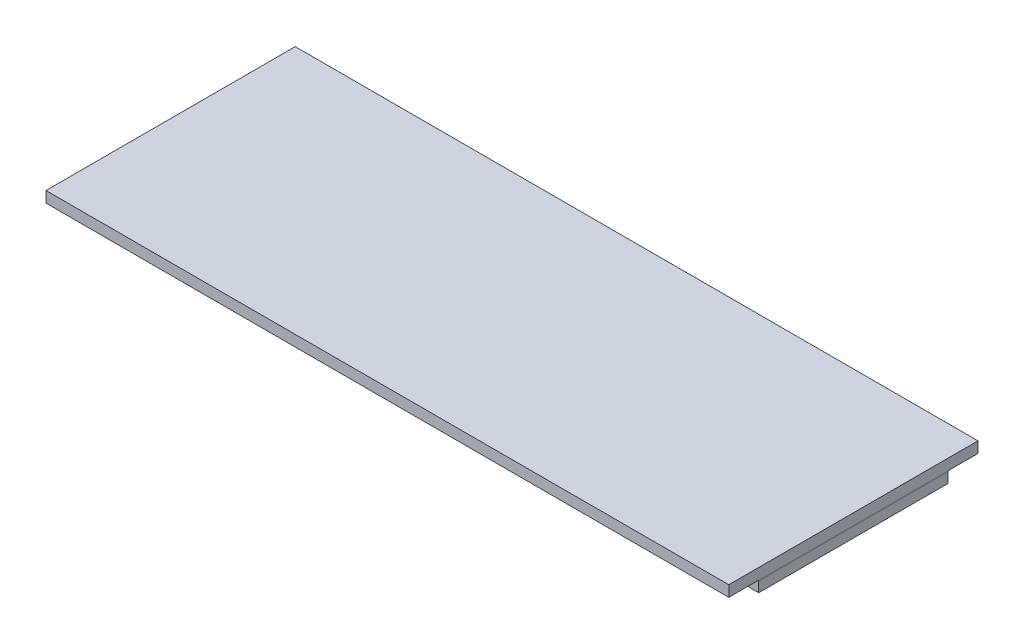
SolidWorks part; units mm, degrees
ref_plane "Front Plane" through (0, 0, 0) normal (0, 0, 1) x (1, 0, 0)
ref_plane "Top Plane" through (0, 0, 0) normal (0, 1, 0) x (1, 0, 0)
ref_plane "Right Plane" through (0, 0, 0) normal (1, 0, 0) x (0, 0, -1)
sketch "Sketch1" plane through (0, 0, 0) normal (0, 1, 0) x (1, 0, 0)
  line L0 (-81.0446, 0) -> (81.0446, 0) construction
  line L1 (-34.25, 12.5) -> (34.25, 12.5)
  line L2 (-34.25, 12.5) -> (-34.25, -12.5)
  line L3 (-34.25, -12.5) -> (34.25, -12.5)
  line L4 (34.25, 12.5) -> (34.25, -12.5)
  line L5 (0, -22.2823) -> (0, 22.2823) construction
  dimension "D1" = 68.5
  dimension "D2" = 25
  dimension "D3" = 12.5
  dimension "D4" = 34.25
extrude "Boss-Extrude1" add sketch "Sketch1" along normal blind 1.1
sketch "Sketch2" plane through (0, 0, 0) normal (0, 1, 0) x (1, 0, 0)
  line L0 (-34.25, 12.5) -> (-34.25, -12.5) construction
  line L1 (-34.25, 9.5) -> (34.25, 9.5)
  line L2 (-34.25, 9.5) -> (-34.25, -9.5)
  line L3 (-34.25, -9.5) -> (34.25, -9.5)
  line L4 (34.25, 9.5) -> (34.25, -9.5)
  line L5 (34.25, -12.5) -> (34.25, 12.5) construction
  line L6 (-55, 0) -> (55, 0) construction
  dimension "D1" = 19
  dimension "D2" = 9.5
extrude "Boss-Extrude2" add sketch "Sketch2" against normal blind 0.1 separate body
sketch "Sketch3"
  dimension "D1" = 2.95
  dimension "D2" = 0.1
  dimension "D3" = 4.35
  dimension "D4" = 25.9
  dimension "D5" = 4.75
  dimension "D6" = 0.51
  dimension "D7" = 0.05
  dimension "D8" = 16
  dimension "D10" = 3.65
  dimension "D11" = 5.15
  dimension "D9" = 2
sketch "Sketch5" plane through (0, 0, 0) normal (0, 1, 0) x (1, 0, 0)
  line L0 (0.35, 2.05) -> (0.86, 2.05) construction
  line L1 (-8.16, 4.2) -> (-7.65, 4.2)
  line L2 (-8.16, 4.2) -> (-8.16, 3.7)
  line L3 (-8.16, 3.7) -> (-7.65, 3.7)
  line L4 (-7.65, 4.2) -> (-7.65, 3.7)
  line L5 (-8.77, 4.75) -> (-8.26, 4.75)
  line L6 (-8.77, 4.75) -> (-8.77, 4.25)
  line L7 (-8.77, 4.25) -> (-8.26, 4.25)
  line L8 (-8.26, 4.75) -> (-8.26, 4.25)
  line L9 (-9.38, 4.75) -> (-8.87, 4.75)
  line L10 (-9.38, 4.75) -> (-9.38, 4.25)
  line L11 (-9.38, 4.25) -> (-8.87, 4.25)
  line L12 (-8.87, 4.75) -> (-8.87, 4.25)
  line L13 (-9.99, 4.75) -> (-9.48, 4.75)
  line L14 (-9.99, 4.75) -> (-9.99, 4.25)
  line L15 (-9.99, 4.25) -> (-9.48, 4.25)
  line L16 (-9.48, 4.75) -> (-9.48, 4.25)
  line L17 (-10.6, 4.2) -> (-10.09, 4.2)
  line L18 (-10.6, 4.2) -> (-10.6, 3.7)
  line L19 (-10.6, 3.7) -> (-10.09, 3.7)
  line L20 (-10.09, 4.2) -> (-10.09, 3.7)
  line L21 (-10.6, 3.65) -> (-10.09, 3.65)
  line L22 (-10.6, 3.65) -> (-10.6, 3.15)
  line L23 (-10.6, 3.15) -> (-10.09, 3.15)
  line L24 (-10.09, 3.65) -> (-10.09, 3.15)
  line L25 (-10.6, 3.1) -> (-10.09, 3.1)
  line L26 (-10.6, 3.1) -> (-10.6, 2.6)
  line L27 (-10.6, 2.6) -> (-10.09, 2.6)
  line L28 (-10.09, 3.1) -> (-10.09, 2.6)
  line L29 (-10.6, 2.55) -> (-10.09, 2.55)
  line L30 (-10.6, 2.55) -> (-10.6, 2.05)
  line L31 (-10.6, 2.05) -> (-10.09, 2.05)
  line L32 (-10.09, 2.55) -> (-10.09, 2.05)
  line L33 (-10.6, 2) -> (-10.09, 2)
  line L34 (-10.6, 2) -> (-10.6, 1.5)
  line L35 (-10.6, 1.5) -> (-10.09, 1.5)
  line L36 (-10.09, 2) -> (-10.09, 1.5)
  line L37 (-9.99, 1.45) -> (-9.48, 1.45)
  line L38 (-9.99, 1.45) -> (-9.99, 0.95)
  line L39 (-9.99, 0.95) -> (-9.48, 0.95)
  line L40 (-9.48, 1.45) -> (-9.48, 0.95)
  line L41 (-9.38, 1.45) -> (-8.87, 1.45)
  line L42 (-9.38, 1.45) -> (-9.38, 0.95)
  line L43 (-9.38, 0.95) -> (-8.87, 0.95)
  line L44 (-8.87, 1.45) -> (-8.87, 0.95)
  line L45 (-8.77, 1.45) -> (-8.26, 1.45)
  line L46 (-8.77, 1.45) -> (-8.77, 0.95)
  line L47 (-8.77, 0.95) -> (-8.26, 0.95)
  line L48 (-8.26, 1.45) -> (-8.26, 0.95)
  line L49 (-8.16, 1.45) -> (-7.65, 1.45)
  line L50 (-8.16, 1.45) -> (-8.16, 0.95)
  line L51 (-8.16, 0.95) -> (-7.65, 0.95)
  line L52 (-7.65, 1.45) -> (-7.65, 0.95)
  line L53 (-6.95, 1.45) -> (-6.44, 1.45)
  line L54 (-6.95, 1.45) -> (-6.95, 0.95)
  line L55 (-6.95, 0.95) -> (-6.44, 0.95)
  line L56 (-6.44, 1.45) -> (-6.44, 0.95)
  line L57 (-8.16, 2) -> (-7.65, 2)
  line L58 (-8.16, 2) -> (-8.16, 1.5)
  line L59 (-8.16, 1.5) -> (-7.65, 1.5)
  line L60 (-7.65, 2) -> (-7.65, 1.5)
  line L61 (-8.16, 2.55) -> (-7.65, 2.55)
  line L62 (-8.16, 2.55) -> (-8.16, 2.05)
  line L63 (-8.16, 2.05) -> (-7.65, 2.05)
  line L64 (-7.65, 2.55) -> (-7.65, 2.05)
  line L65 (-8.16, 3.1) -> (-7.65, 3.1)
  line L66 (-8.16, 3.1) -> (-8.16, 2.6)
  line L67 (-8.16, 2.6) -> (-7.65, 2.6)
  line L68 (-7.65, 3.1) -> (-7.65, 2.6)
  line L69 (-8.77, 3.1) -> (-8.26, 3.1)
  line L70 (-8.77, 3.1) -> (-8.77, 2.6)
  line L71 (-8.77, 2.6) -> (-8.26, 2.6)
  line L72 (-8.26, 3.1) -> (-8.26, 2.6)
  line L73 (-9.38, 3.1) -> (-8.87, 3.1)
  line L74 (-9.38, 3.1) -> (-9.38, 2.6)
  line L75 (-9.38, 2.6) -> (-8.87, 2.6)
  line L76 (-8.87, 3.1) -> (-8.87, 2.6)
  line L77 (-6.95, 2) -> (-6.44, 2)
  line L78 (-6.95, 2) -> (-6.95, 1.5)
  line L79 (-6.95, 1.5) -> (-6.44, 1.5)
  line L80 (-6.44, 2) -> (-6.44, 1.5)
  line L81 (-6.95, 2.55) -> (-6.44, 2.55)
  line L82 (-6.95, 2.55) -> (-6.95, 2.05)
  line L83 (-6.95, 2.05) -> (-6.44, 2.05)
  line L84 (-6.44, 2.55) -> (-6.44, 2.05)
  line L85 (-6.95, 3.1) -> (-6.44, 3.1)
  line L86 (-6.95, 3.1) -> (-6.95, 2.6)
  line L87 (-6.95, 2.6) -> (-6.44, 2.6)
  line L88 (-6.44, 3.1) -> (-6.44, 2.6)
  line L89 (-6.95, 3.65) -> (-6.44, 3.65)
  line L90 (-6.95, 3.65) -> (-6.95, 3.15)
  line L91 (-6.95, 3.15) -> (-6.44, 3.15)
  line L92 (-6.44, 3.65) -> (-6.44, 3.15)
  line L93 (-6.34, 3.1) -> (-5.83, 3.1)
  line L94 (-6.34, 3.1) -> (-6.34, 2.6)
  line L95 (-6.34, 2.6) -> (-5.83, 2.6)
  line L96 (-5.83, 3.1) -> (-5.83, 2.6)
  line L97 (-5.73, 3.65) -> (-5.22, 3.65)
  line L98 (-5.73, 3.65) -> (-5.73, 3.15)
  line L99 (-5.73, 3.15) -> (-5.22, 3.15)
  line L100 (-5.22, 3.65) -> (-5.22, 3.15)
  line L101 (-5.12, 3.65) -> (-4.61, 3.65)
  line L102 (-5.12, 3.65) -> (-5.12, 3.15)
  line L103 (-5.12, 3.15) -> (-4.61, 3.15)
  line L104 (-4.61, 3.65) -> (-4.61, 3.15)
  line L105 (-4.51, 3.1) -> (-4, 3.1)
  line L106 (-4.51, 3.1) -> (-4.51, 2.6)
  line L107 (-4.51, 2.6) -> (-4, 2.6)
  line L108 (-4, 3.1) -> (-4, 2.6)
  line L109 (-3.3, 2) -> (-2.79, 2)
  line L110 (-3.3, 2) -> (-3.3, 1.5)
  line L111 (-3.3, 1.5) -> (-2.79, 1.5)
  line L112 (-2.79, 2) -> (-2.79, 1.5)
  line L113 (-2.69, 1.45) -> (-2.18, 1.45)
  line L114 (-2.69, 1.45) -> (-2.69, 0.95)
  line L115 (-2.69, 0.95) -> (-2.18, 0.95)
  line L116 (-2.18, 1.45) -> (-2.18, 0.95)
  line L117 (-2.08, 1.45) -> (-1.57, 1.45)
  line L118 (-2.08, 1.45) -> (-2.08, 0.95)
  line L119 (-2.08, 0.95) -> (-1.57, 0.95)
  line L120 (-1.57, 1.45) -> (-1.57, 0.95)
  line L121 (-0.96, 1.45) -> (-1.47, 1.45)
  line L122 (-0.96, 1.45) -> (-0.96, 0.95)
  line L123 (-0.96, 0.95) -> (-1.47, 0.95)
  line L124 (-1.47, 1.45) -> (-1.47, 0.95)
  line L125 (-0.35, 2) -> (-0.86, 2)
  line L126 (-0.35, 2) -> (-0.35, 1.5)
  line L127 (-0.35, 1.5) -> (-0.86, 1.5)
  line L128 (-0.86, 2) -> (-0.86, 1.5)
  line L129 (-0.86, 1.45) -> (-0.35, 1.45)
  line L130 (-0.86, 1.45) -> (-0.86, 0.95)
  line L131 (-0.86, 0.95) -> (-0.35, 0.95)
  line L132 (-0.35, 1.45) -> (-0.35, 0.95)
  line L133 (-2.69, 2.55) -> (-2.18, 2.55)
  line L134 (-2.69, 2.55) -> (-2.69, 2.05)
  line L135 (-2.69, 2.05) -> (-2.18, 2.05)
  line L136 (-2.18, 2.55) -> (-2.18, 2.05)
  line L137 (-2.08, 2.55) -> (-1.57, 2.55)
  line L138 (-2.08, 2.55) -> (-2.08, 2.05)
  line L139 (-2.08, 2.05) -> (-1.57, 2.05)
  line L140 (-1.57, 2.55) -> (-1.57, 2.05)
  line L141 (-1.47, 2.55) -> (-0.96, 2.55)
  line L142 (-1.47, 2.55) -> (-1.47, 2.05)
  line L143 (-1.47, 2.05) -> (-0.96, 2.05)
  line L144 (-0.96, 2.55) -> (-0.96, 2.05)
  line L145 (-0.86, 2.55) -> (-0.35, 2.55)
  line L146 (-0.86, 2.55) -> (-0.86, 2.05)
  line L147 (-0.86, 2.05) -> (-0.35, 2.05)
  line L148 (-0.35, 2.55) -> (-0.35, 2.05)
  line L149 (-2.69, 3.65) -> (-2.18, 3.65)
  line L150 (-2.69, 3.65) -> (-2.69, 3.15)
  line L151 (-2.69, 3.15) -> (-2.18, 3.15)
  line L152 (-2.18, 3.65) -> (-2.18, 3.15)
  line L153 (-2.08, 3.65) -> (-1.57, 3.65)
  line L154 (-2.08, 3.65) -> (-2.08, 3.15)
  line L155 (-2.08, 3.15) -> (-1.57, 3.15)
  line L156 (-1.57, 3.65) -> (-1.57, 3.15)
  line L157 (-1.47, 3.65) -> (-0.96, 3.65)
  line L158 (-1.47, 3.65) -> (-1.47, 3.15)
  line L159 (-1.47, 3.15) -> (-0.96, 3.15)
  line L160 (-0.96, 3.65) -> (-0.96, 3.15)
  line L161 (-0.86, 3.1) -> (-0.35, 3.1)
  line L162 (-0.86, 3.1) -> (-0.86, 2.6)
  line L163 (-0.86, 2.6) -> (-0.35, 2.6)
  line L164 (-0.35, 3.1) -> (-0.35, 2.6)
  line L165 (0.35, 4.75) -> (0.86, 4.75)
  line L166 (0.35, 4.75) -> (0.35, 4.25)
  line L167 (0.35, 4.25) -> (0.86, 4.25)
  line L168 (0.86, 4.75) -> (0.86, 4.25)
  line L169 (0.35, 4.2) -> (0.86, 4.2)
  line L170 (0.35, 4.2) -> (0.35, 3.7)
  line L171 (0.35, 3.7) -> (0.86, 3.7)
  line L172 (0.86, 4.2) -> (0.86, 3.7)
  line L173 (0.35, 3.65) -> (0.86, 3.65)
  line L174 (0.35, 3.65) -> (0.35, 3.15)
  line L175 (0.35, 3.15) -> (0.86, 3.15)
  line L176 (0.86, 3.65) -> (0.86, 3.15)
  line L177 (0.35, 3.1) -> (0.86, 3.1)
  line L178 (0.35, 3.1) -> (0.35, 2.6)
  line L179 (0.35, 2.6) -> (0.86, 2.6)
  line L180 (0.86, 3.1) -> (0.86, 2.6)
  line L181 (0.35, 2.55) -> (0.86, 2.55)
  line L182 (0.35, 2.55) -> (0.35, 2.05)
  line L183 (0.35, 2.05) -> (0.86, 2.05)
  line L184 (0.86, 2.55) -> (0.86, 2.05)
  line L185 (0.86, 2.05) -> (0.86, 2.55) construction
  line L186 (10.6, 1.5) -> (10.6, 2) construction
  line L187 (0.35, 2) -> (0.86, 2)
  line L188 (0.35, 2) -> (0.35, 1.5)
  line L189 (0.35, 1.5) -> (0.86, 1.5)
  line L190 (0.86, 2) -> (0.86, 1.5)
  line L191 (0.35, 1.45) -> (0.86, 1.45)
  line L192 (0.35, 1.45) -> (0.35, 0.9)
  line L193 (0.35, 0.9) -> (0.86, 0.9)
  line L194 (0.86, 1.45) -> (0.86, 0.9)
  line L195 (0.96, 1.45) -> (1.47, 1.45)
  line L196 (0.96, 1.45) -> (0.96, 0.95)
  line L197 (0.96, 0.95) -> (1.47, 0.95)
  line L198 (1.47, 1.45) -> (1.47, 0.95)
  line L199 (1.57, 1.45) -> (2.08, 1.45)
  line L200 (1.57, 1.45) -> (1.57, 0.95)
  line L201 (1.57, 0.95) -> (2.08, 0.95)
  line L202 (2.08, 1.45) -> (2.08, 0.95)
  line L203 (2.18, 1.45) -> (2.69, 1.45)
  line L204 (2.18, 1.45) -> (2.18, 0.95)
  line L205 (2.18, 0.95) -> (2.69, 0.95)
  line L206 (2.69, 1.45) -> (2.69, 0.95)
  line L207 (0.96, 3.1) -> (1.47, 3.1)
  line L208 (0.96, 3.1) -> (0.96, 2.6)
  line L209 (0.96, 2.6) -> (1.47, 2.6)
  line L210 (1.47, 3.1) -> (1.47, 2.6)
  line L211 (1.57, 3.65) -> (2.08, 3.65)
  line L212 (1.57, 3.65) -> (1.57, 3.15)
  line L213 (1.57, 3.15) -> (2.08, 3.15)
  line L214 (2.08, 3.65) -> (2.08, 3.15)
  line L215 (2.18, 3.65) -> (2.69, 3.65)
  line L216 (2.18, 3.65) -> (2.18, 3.15)
  line L217 (2.18, 3.15) -> (2.69, 3.15)
  line L218 (2.69, 3.65) -> (2.69, 3.15)
  line L219 (2.79, 3.1) -> (3.3, 3.1)
  line L220 (2.79, 3.1) -> (2.79, 2.6)
  line L221 (2.79, 2.6) -> (3.3, 2.6)
  line L222 (3.3, 3.1) -> (3.3, 2.6)
  line L223 (2.79, 2.55) -> (3.3, 2.55)
  line L224 (2.79, 2.55) -> (2.79, 2.05)
  line L225 (2.79, 2.05) -> (3.3, 2.05)
  line L226 (3.3, 2.55) -> (3.3, 2.05)
  line L227 (2.79, 2) -> (3.3, 2)
  line L228 (2.79, 2) -> (2.79, 1.5)
  line L229 (2.79, 1.5) -> (3.3, 1.5)
  line L230 (3.3, 2) -> (3.3, 1.5)
  line L231 (4.61, 3.65) -> (5.12, 3.65)
  line L232 (4.61, 3.65) -> (4.61, 3.15)
  line L233 (4.61, 3.15) -> (5.12, 3.15)
  line L234 (5.12, 3.65) -> (5.12, 3.15)
  line L235 (4, 3.1) -> (4.51, 3.1)
  line L236 (4, 3.1) -> (4, 2.6)
  line L237 (4, 2.6) -> (4.51, 2.6)
  line L238 (4.51, 3.1) -> (4.51, 2.6)
  line L239 (4, 2.55) -> (4.51, 2.55)
  line L240 (4, 2.55) -> (4, 2.05)
  line L241 (4, 2.05) -> (4.51, 2.05)
  line L242 (4.51, 2.55) -> (4.51, 2.05)
  line L243 (4, 2) -> (4.51, 2)
  line L244 (4, 2) -> (4, 1.5)
  line L245 (4, 1.5) -> (4.51, 1.5)
  line L246 (4.51, 2) -> (4.51, 1.5)
  line L247 (4.61, 1.45) -> (5.12, 1.45)
  line L248 (4.61, 1.45) -> (4.61, 0.95)
  line L249 (4.61, 0.95) -> (5.12, 0.95)
  line L250 (5.12, 1.45) -> (5.12, 0.95)
  line L251 (5.22, 1.45) -> (5.73, 1.45)
  line L252 (5.22, 1.45) -> (5.22, 0.95)
  line L253 (5.22, 0.95) -> (5.73, 0.95)
  line L254 (5.73, 1.45) -> (5.73, 0.95)
  line L255 (5.83, 1.45) -> (6.34, 1.45)
  line L256 (5.83, 1.45) -> (5.83, 0.95)
  line L257 (5.83, 0.95) -> (6.34, 0.95)
  line L258 (6.34, 1.45) -> (6.34, 0.95)
  line L259 (5.22, 3.65) -> (5.73, 3.65)
  line L260 (5.22, 3.65) -> (5.22, 3.15)
  line L261 (5.22, 3.15) -> (5.73, 3.15)
  line L262 (5.73, 3.65) -> (5.73, 3.15)
  line L263 (5.83, 3.65) -> (6.34, 3.65)
  line L264 (5.83, 3.65) -> (5.83, 3.15)
  line L265 (5.83, 3.15) -> (6.34, 3.15)
  line L266 (6.34, 3.65) -> (6.34, 3.15)
  line L267 (6.44, 2) -> (6.95, 2)
  line L268 (6.44, 2) -> (6.44, 1.5)
  line L269 (6.44, 1.5) -> (6.95, 1.5)
  line L270 (6.95, 2) -> (6.95, 1.5)
  line L271 (8.26, 3.65) -> (8.77, 3.65)
  line L272 (8.26, 3.65) -> (8.26, 3.15)
  line L273 (8.26, 3.15) -> (8.77, 3.15)
  line L274 (8.77, 3.65) -> (8.77, 3.15)
  line L275 (8.87, 3.65) -> (9.38, 3.65)
  line L276 (8.87, 3.65) -> (8.87, 3.15)
  line L277 (8.87, 3.15) -> (9.38, 3.15)
  line L278 (9.38, 3.65) -> (9.38, 3.15)
  line L279 (9.48, 3.65) -> (9.99, 3.65)
  line L280 (9.48, 3.65) -> (9.48, 3.15)
  line L281 (9.48, 3.15) -> (9.99, 3.15)
  line L282 (9.99, 3.65) -> (9.99, 3.15)
  line L283 (10.09, 3.1) -> (10.6, 3.1)
  line L284 (10.09, 3.1) -> (10.09, 2.6)
  line L285 (10.09, 2.6) -> (10.6, 2.6)
  line L286 (10.6, 3.1) -> (10.6, 2.6)
  line L287 (7.65, 2) -> (8.16, 2)
  line L288 (7.65, 2) -> (7.65, 1.5)
  line L289 (7.65, 1.5) -> (8.16, 1.5)
  line L290 (8.16, 2) -> (8.16, 1.5)
  line L291 (8.26, 1.45) -> (8.77, 1.45)
  line L292 (8.26, 1.45) -> (8.26, 0.95)
  line L293 (8.26, 0.95) -> (8.77, 0.95)
  line L294 (8.77, 1.45) -> (8.77, 0.95)
  line L295 (8.26, 2.55) -> (8.77, 2.55)
  line L296 (8.26, 2.55) -> (8.26, 2.05)
  line L297 (8.26, 2.05) -> (8.77, 2.05)
  line L298 (8.77, 2.55) -> (8.77, 2.05)
  line L299 (8.87, 2.55) -> (9.38, 2.55)
  line L300 (8.87, 2.55) -> (8.87, 2.05)
  line L301 (8.87, 2.05) -> (9.38, 2.05)
  line L302 (9.38, 2.55) -> (9.38, 2.05)
  line L303 (9.48, 2.55) -> (9.99, 2.55)
  line L304 (9.48, 2.55) -> (9.48, 2.05)
  line L305 (9.48, 2.05) -> (9.99, 2.05)
  line L306 (9.99, 2.55) -> (9.99, 2.05)
  line L307 (10.09, 2.55) -> (10.6, 2.55)
  line L308 (10.09, 2.55) -> (10.09, 2.05)
  line L309 (10.09, 2.05) -> (10.6, 2.05)
  line L310 (10.6, 2.55) -> (10.6, 2.05)
  line L311 (10.6, 2) -> (10.09, 2)
  line L312 (10.6, 2) -> (10.6, 1.5)
  line L313 (10.6, 1.5) -> (10.09, 1.5)
  line L314 (10.09, 2) -> (10.09, 1.5)
  line L316 (8.87, 1.45) -> (9.38, 1.45)
  line L317 (8.87, 1.45) -> (8.87, 0.95)
  line L318 (8.87, 0.95) -> (9.38, 0.95)
  line L319 (9.38, 1.45) -> (9.38, 0.95)
  line L320 (9.48, 1.45) -> (9.99, 1.45)
  line L321 (9.48, 1.45) -> (9.48, 0.95)
  line L322 (9.48, 0.95) -> (9.99, 0.95)
  line L323 (9.99, 1.45) -> (9.99, 0.95)
  line L324 (10.09, 1.45) -> (10.6, 1.45)
  line L325 (10.09, 1.45) -> (10.09, 0.95)
  line L326 (10.09, 0.95) -> (10.6, 0.95)
  line L327 (10.6, 1.45) -> (10.6, 0.95)
  line L328 (14.25, 1.45) -> (13.74, 1.45)
  line L329 (14.25, 1.45) -> (14.25, 0.95)
  line L330 (14.25, 0.95) -> (13.74, 0.95)
  line L331 (13.74, 1.45) -> (13.74, 0.95)
  line L332 (13.74, 2) -> (14.25, 2)
  line L333 (13.74, 2) -> (13.74, 1.5)
  line L334 (13.74, 1.5) -> (14.25, 1.5)
  line L335 (14.25, 2) -> (14.25, 1.5)
  line L336 (13.74, 4.75) -> (14.25, 4.75)
  line L337 (13.74, 4.75) -> (13.74, 4.25)
  line L338 (13.74, 4.25) -> (14.25, 4.25)
  line L339 (14.25, 4.75) -> (14.25, 4.25)
  line L340 (13.74, 4.2) -> (14.25, 4.2)
  line L341 (13.74, 4.2) -> (13.74, 3.7)
  line L342 (13.74, 3.7) -> (14.25, 3.7)
  line L343 (14.25, 4.2) -> (14.25, 3.7)
  line L344 (13.74, 3.65) -> (14.25, 3.65)
  line L345 (13.74, 3.65) -> (13.74, 3.15)
  line L346 (13.74, 3.15) -> (14.25, 3.15)
  line L347 (14.25, 3.65) -> (14.25, 3.15)
  line L348 (14.25, 3.1) -> (13.74, 3.1)
  line L349 (14.25, 3.1) -> (14.25, 2.6)
  line L350 (14.25, 2.6) -> (13.74, 2.6)
  line L351 (13.74, 3.1) -> (13.74, 2.6)
  line L352 (13.74, 2.55) -> (14.25, 2.55)
  line L353 (13.74, 2.55) -> (13.74, 2.05)
  line L354 (13.74, 2.05) -> (14.25, 2.05)
  line L355 (14.25, 2.55) -> (14.25, 2.05)
  line L356 (13.13, 1.45) -> (13.64, 1.45)
  line L357 (13.13, 1.45) -> (13.13, 0.95)
  line L358 (13.13, 0.95) -> (13.64, 0.95)
  line L359 (13.64, 1.45) -> (13.64, 0.95)
  line L360 (12.52, 1.45) -> (13.03, 1.45)
  line L361 (12.52, 1.45) -> (12.52, 0.95)
  line L362 (12.52, 0.95) -> (13.03, 0.95)
  line L363 (13.03, 1.45) -> (13.03, 0.95)
  line L364 (11.91, 1.45) -> (12.42, 1.45)
  line L365 (11.91, 1.45) -> (11.91, 0.95)
  line L366 (11.91, 0.95) -> (12.42, 0.95)
  line L367 (12.42, 1.45) -> (12.42, 0.95)
  line L368 (11.3, 2) -> (11.81, 2)
  line L369 (11.3, 2) -> (11.3, 1.5)
  line L370 (11.3, 1.5) -> (11.81, 1.5)
  line L371 (11.81, 2) -> (11.81, 1.5)
  line L372 (11.3, 2.55) -> (11.81, 2.55)
  line L373 (11.3, 2.55) -> (11.3, 2.05)
  line L374 (11.3, 2.05) -> (11.81, 2.05)
  line L375 (11.81, 2.55) -> (11.81, 2.05)
  line L376 (11.3, 3.1) -> (11.81, 3.1)
  line L377 (11.3, 3.1) -> (11.3, 2.6)
  line L378 (11.3, 2.6) -> (11.81, 2.6)
  line L379 (11.81, 3.1) -> (11.81, 2.6)
  line L380 (11.91, 3.65) -> (12.42, 3.65)
  line L381 (11.91, 3.65) -> (11.91, 3.15)
  line L382 (11.91, 3.15) -> (12.42, 3.15)
  line L383 (12.42, 3.65) -> (12.42, 3.15)
  line L384 (12.52, 3.65) -> (13.03, 3.65)
  line L385 (12.52, 3.65) -> (12.52, 3.15)
  line L386 (12.52, 3.15) -> (13.03, 3.15)
  line L387 (13.03, 3.65) -> (13.03, 3.15)
  line L388 (13.13, 3.1) -> (13.64, 3.1)
  line L389 (13.13, 3.1) -> (13.13, 2.6)
  line L390 (13.13, 2.6) -> (13.64, 2.6)
  line L391 (13.64, 3.1) -> (13.64, 2.6)
extrude "Grabcad" cut sketch "Sketch5" against normal blind 1
sketch "Sketch6" plane through (0, 0, 0) normal (0, 1, 0) x (1, 0, 0)
  line L1 (-27.63, -0.4) -> (-27.12, -0.4)
  line L2 (-27.63, -0.4) -> (-27.63, -0.9)
  line L3 (-27.63, -0.9) -> (-27.12, -0.9)
  line L4 (-27.12, -0.4) -> (-27.12, -0.9)
  line L5 (-27.63, -0.95) -> (-27.12, -0.95)
  line L6 (-27.63, -0.95) -> (-27.63, -1.45)
  line L7 (-27.63, -1.45) -> (-27.12, -1.45)
  line L8 (-27.12, -0.95) -> (-27.12, -1.45)
  line L9 (-27.63, -1.5) -> (-27.12, -1.5)
  line L10 (-27.63, -1.5) -> (-27.63, -2)
  line L11 (-27.63, -2) -> (-27.12, -2)
  line L12 (-27.12, -1.5) -> (-27.12, -2)
  line L13 (-27.63, -2.05) -> (-27.12, -2.05)
  line L14 (-27.63, -2.05) -> (-27.63, -2.55)
  line L15 (-27.63, -2.55) -> (-27.12, -2.55)
  line L16 (-27.12, -2.05) -> (-27.12, -2.55)
  line L17 (-27.63, -2.6) -> (-27.12, -2.6)
  line L18 (-27.63, -2.6) -> (-27.63, -3.1)
  line L19 (-27.63, -3.1) -> (-27.12, -3.1)
  line L20 (-27.12, -2.6) -> (-27.12, -3.1)
  line L21 (-27.63, -3.15) -> (-27.12, -3.15)
  line L22 (-27.63, -3.15) -> (-27.63, -3.65)
  line L23 (-27.63, -3.65) -> (-27.12, -3.65)
  line L24 (-27.12, -3.15) -> (-27.12, -3.65)
  line L25 (-27.12, -3.7) -> (-27.63, -3.7)
  line L26 (-27.12, -3.7) -> (-27.12, -4.2)
  line L27 (-27.12, -4.2) -> (-27.63, -4.2)
  line L28 (-27.63, -3.7) -> (-27.63, -4.2)
  line L29 (-28.24, -3.7) -> (-27.73, -3.7)
  line L30 (-28.24, -3.7) -> (-28.24, -4.2)
  line L31 (-28.24, -4.2) -> (-27.73, -4.2)
  line L32 (-27.73, -3.7) -> (-27.73, -4.2)
  line L33 (-27.02, -3.7) -> (-26.51, -3.7)
  line L34 (-27.02, -3.7) -> (-27.02, -4.2)
  line L35 (-27.02, -4.2) -> (-26.51, -4.2)
  line L36 (-26.51, -3.7) -> (-26.51, -4.2)
  line L37 (-28.24, -0.95) -> (-27.73, -0.95)
  line L38 (-28.24, -0.95) -> (-28.24, -1.45)
  line L39 (-28.24, -1.45) -> (-27.73, -1.45)
  line L40 (-27.73, -0.95) -> (-27.73, -1.45)
  line L41 (-22.76, -2.6) -> (-22.25, -2.6)
  line L42 (-22.76, -2.6) -> (-22.76, -3.1)
  line L43 (-22.76, -3.1) -> (-22.25, -3.1)
  line L44 (-22.25, -2.6) -> (-22.25, -3.1)
  line L45 (-22.76, -3.15) -> (-22.25, -3.15)
  line L46 (-22.76, -3.15) -> (-22.76, -3.65)
  line L47 (-22.76, -3.65) -> (-22.25, -3.65)
  line L48 (-22.25, -3.15) -> (-22.25, -3.65)
  line L49 (-23.37, -3.7) -> (-22.86, -3.7)
  line L50 (-23.37, -3.7) -> (-23.37, -4.2)
  line L51 (-23.37, -4.2) -> (-22.86, -4.2)
  line L52 (-22.86, -3.7) -> (-22.86, -4.2)
  line L53 (-23.98, -3.7) -> (-23.47, -3.7)
  line L54 (-23.98, -3.7) -> (-23.98, -4.2)
  line L55 (-23.98, -4.2) -> (-23.47, -4.2)
  line L56 (-23.47, -3.7) -> (-23.47, -4.2)
  line L57 (-24.59, -3.7) -> (-24.08, -3.7)
  line L58 (-24.59, -3.7) -> (-24.59, -4.2)
  line L59 (-24.59, -4.2) -> (-24.08, -4.2)
  line L60 (-24.08, -3.7) -> (-24.08, -4.2)
  line L61 (-25.2, -3.15) -> (-24.69, -3.15)
  line L62 (-25.2, -3.15) -> (-25.2, -3.65)
  line L63 (-25.2, -3.65) -> (-24.69, -3.65)
  line L64 (-24.69, -3.15) -> (-24.69, -3.65)
  line L65 (-25.2, -2.6) -> (-24.69, -2.6)
  line L66 (-25.2, -2.6) -> (-25.2, -3.1)
  line L67 (-25.2, -3.1) -> (-24.69, -3.1)
  line L68 (-24.69, -2.6) -> (-24.69, -3.1)
  line L69 (-25.2, -2.05) -> (-24.69, -2.05)
  line L70 (-25.2, -2.05) -> (-25.2, -2.55)
  line L71 (-25.2, -2.55) -> (-24.69, -2.55)
  line L72 (-24.69, -2.05) -> (-24.69, -2.55)
  line L73 (-23.37, -0.4) -> (-22.86, -0.4)
  line L74 (-23.37, -0.4) -> (-23.37, -0.9)
  line L75 (-23.37, -0.9) -> (-22.86, -0.9)
  line L76 (-22.86, -0.4) -> (-22.86, -0.9)
  line L77 (-23.98, -0.4) -> (-23.47, -0.4)
  line L78 (-23.98, -0.4) -> (-23.98, -0.9)
  line L79 (-23.98, -0.9) -> (-23.47, -0.9)
  line L80 (-23.47, -0.4) -> (-23.47, -0.9)
  line L81 (-24.59, -0.95) -> (-24.08, -0.95)
  line L82 (-24.59, -0.95) -> (-24.59, -1.45)
  line L83 (-24.59, -1.45) -> (-24.08, -1.45)
  line L84 (-24.08, -0.95) -> (-24.08, -1.45)
  line L85 (-25.2, -1.5) -> (-24.69, -1.5)
  line L86 (-25.2, -1.5) -> (-25.2, -2)
  line L87 (-25.2, -2) -> (-24.69, -2)
  line L88 (-24.69, -1.5) -> (-24.69, -2)
  line L89 (-24.59, -2.05) -> (-24.08, -2.05)
  line L90 (-24.59, -2.05) -> (-24.59, -2.55)
  line L91 (-24.59, -2.55) -> (-24.08, -2.55)
  line L92 (-24.08, -2.05) -> (-24.08, -2.55)
  line L93 (-23.98, -2.05) -> (-23.47, -2.05)
  line L94 (-23.98, -2.05) -> (-23.98, -2.55)
  line L95 (-23.98, -2.55) -> (-23.47, -2.55)
  line L96 (-23.47, -2.05) -> (-23.47, -2.55)
  line L97 (-23.37, -2.05) -> (-22.86, -2.05)
  line L98 (-23.37, -2.05) -> (-23.37, -2.55)
  line L99 (-23.37, -2.55) -> (-22.86, -2.55)
  line L100 (-22.86, -2.05) -> (-22.86, -2.55)
  line L101 (-21.55, -3.7) -> (-21.04, -3.7)
  line L102 (-21.55, -3.7) -> (-21.55, -4.2)
  line L103 (-21.55, -4.2) -> (-21.04, -4.2)
  line L104 (-21.04, -3.7) -> (-21.04, -4.2)
  line L105 (-20.94, -3.15) -> (-20.43, -3.15)
  line L106 (-20.94, -3.15) -> (-20.94, -3.65)
  line L107 (-20.94, -3.65) -> (-20.43, -3.65)
  line L108 (-20.43, -3.15) -> (-20.43, -3.65)
  line L109 (-20.33, -2.6) -> (-19.82, -2.6)
  line L110 (-20.33, -2.6) -> (-20.33, -3.1)
  line L111 (-20.33, -3.1) -> (-19.82, -3.1)
  line L112 (-19.82, -2.6) -> (-19.82, -3.1)
  line L113 (-19.72, -2.05) -> (-19.21, -2.05)
  line L114 (-19.72, -2.05) -> (-19.72, -2.55)
  line L115 (-19.72, -2.55) -> (-19.21, -2.55)
  line L116 (-19.21, -2.05) -> (-19.21, -2.55)
  line L117 (-19.11, -1.5) -> (-18.6, -1.5)
  line L118 (-19.11, -1.5) -> (-19.11, -2)
  line L119 (-19.11, -2) -> (-18.6, -2)
  line L120 (-18.6, -1.5) -> (-18.6, -2)
  line L121 (-20.94, -2.05) -> (-20.43, -2.05)
  line L122 (-20.94, -2.05) -> (-20.94, -2.55)
  line L123 (-20.94, -2.55) -> (-20.43, -2.55)
  line L124 (-20.43, -2.05) -> (-20.43, -2.55)
  line L125 (-21.55, -1.5) -> (-21.04, -1.5)
  line L126 (-21.55, -1.5) -> (-21.55, -2)
  line L127 (-21.55, -2) -> (-21.04, -2)
  line L128 (-21.04, -1.5) -> (-21.04, -2)
  line L129 (-19.72, -3.15) -> (-19.21, -3.15)
  line L130 (-19.72, -3.15) -> (-19.72, -3.65)
  line L131 (-19.72, -3.65) -> (-19.21, -3.65)
  line L132 (-19.21, -3.15) -> (-19.21, -3.65)
  line L133 (-19.11, -3.7) -> (-18.6, -3.7)
  line L134 (-19.11, -3.7) -> (-19.11, -4.2)
  line L135 (-19.11, -4.2) -> (-18.6, -4.2)
  line L136 (-18.6, -3.7) -> (-18.6, -4.2)
  line L137 (-17.29, -0.4) -> (-16.78, -0.4)
  line L138 (-17.29, -0.4) -> (-17.29, -0.9)
  line L139 (-17.29, -0.9) -> (-16.78, -0.9)
  line L140 (-16.78, -0.4) -> (-16.78, -0.9)
  line L141 (-16.68, -0.4) -> (-16.17, -0.4)
  line L142 (-16.68, -0.4) -> (-16.68, -0.9)
  line L143 (-16.68, -0.9) -> (-16.17, -0.9)
  line L144 (-16.17, -0.4) -> (-16.17, -0.9)
  line L145 (-16.07, -0.4) -> (-15.56, -0.4)
  line L146 (-16.07, -0.4) -> (-16.07, -0.9)
  line L147 (-16.07, -0.9) -> (-15.56, -0.9)
  line L148 (-15.56, -0.4) -> (-15.56, -0.9)
  line L149 (-15.46, -0.95) -> (-14.95, -0.95)
  line L150 (-15.46, -0.95) -> (-15.46, -1.45)
  line L151 (-15.46, -1.45) -> (-14.95, -1.45)
  line L152 (-14.95, -0.95) -> (-14.95, -1.45)
  line L153 (-15.46, -1.5) -> (-14.95, -1.5)
  line L154 (-15.46, -1.5) -> (-15.46, -2)
  line L155 (-15.46, -2) -> (-14.95, -2)
  line L156 (-14.95, -1.5) -> (-14.95, -2)
  line L157 (-16.07, -2.05) -> (-15.56, -2.05)
  line L158 (-16.07, -2.05) -> (-16.07, -2.55)
  line L159 (-16.07, -2.55) -> (-15.56, -2.55)
  line L160 (-15.56, -2.05) -> (-15.56, -2.55)
  line L161 (-16.68, -2.6) -> (-16.17, -2.6)
  line L162 (-16.68, -2.6) -> (-16.68, -3.1)
  line L163 (-16.68, -3.1) -> (-16.17, -3.1)
  line L164 (-16.17, -2.6) -> (-16.17, -3.1)
  line L165 (-17.29, -3.15) -> (-16.78, -3.15)
  line L166 (-17.29, -3.15) -> (-17.29, -3.65)
  line L167 (-17.29, -3.65) -> (-16.78, -3.65)
  line L168 (-16.78, -3.15) -> (-16.78, -3.65)
  line L169 (-17.9, -3.7) -> (-17.39, -3.7)
  line L170 (-17.9, -3.7) -> (-17.9, -4.2)
  line L171 (-17.9, -4.2) -> (-17.39, -4.2)
  line L172 (-17.39, -3.7) -> (-17.39, -4.2)
  line L173 (-17.29, -3.7) -> (-16.78, -3.7)
  line L174 (-17.29, -3.7) -> (-17.29, -4.2)
  line L175 (-17.29, -4.2) -> (-16.78, -4.2)
  line L176 (-16.78, -3.7) -> (-16.78, -4.2)
  line L177 (-16.68, -3.7) -> (-16.17, -3.7)
  line L178 (-16.68, -3.7) -> (-16.68, -4.2)
  line L179 (-16.68, -4.2) -> (-16.17, -4.2)
  line L180 (-16.17, -3.7) -> (-16.17, -4.2)
  line L181 (-16.07, -4.2) -> (-15.56, -4.2)
  line L182 (-16.07, -4.2) -> (-16.07, -3.7)
  line L183 (-16.07, -3.7) -> (-15.56, -3.7)
  line L184 (-15.56, -4.2) -> (-15.56, -3.7)
  line L185 (-15.46, -4.2) -> (-14.95, -4.2)
  line L186 (-15.46, -4.2) -> (-15.46, -3.7)
  line L187 (-15.46, -3.7) -> (-14.95, -3.7)
  line L188 (-14.95, -4.2) -> (-14.95, -3.7)
  line L189 (-17.9, -0.95) -> (-17.39, -0.95)
  line L190 (-17.9, -0.95) -> (-17.9, -1.45)
  line L191 (-17.9, -1.45) -> (-17.39, -1.45)
  line L192 (-17.39, -0.95) -> (-17.39, -1.45)
  line L193 (-10.6, -0.4) -> (-10.09, -0.4)
  line L194 (-10.6, -0.4) -> (-10.6, -0.9)
  line L195 (-10.6, -0.9) -> (-10.09, -0.9)
  line L196 (-10.09, -0.4) -> (-10.09, -0.9)
  line L197 (-10.6, -0.95) -> (-10.09, -0.95)
  line L198 (-10.6, -0.95) -> (-10.6, -1.45)
  line L199 (-10.6, -1.45) -> (-10.09, -1.45)
  line L200 (-10.09, -0.95) -> (-10.09, -1.45)
  line L201 (-10.6, -1.5) -> (-10.09, -1.5)
  line L202 (-10.6, -1.5) -> (-10.6, -2)
  line L203 (-10.6, -2) -> (-10.09, -2)
  line L204 (-10.09, -1.5) -> (-10.09, -2)
  line L205 (-10.6, -2.05) -> (-10.09, -2.05)
  line L206 (-10.6, -2.05) -> (-10.6, -2.55)
  line L207 (-10.6, -2.55) -> (-10.09, -2.55)
  line L208 (-10.09, -2.05) -> (-10.09, -2.55)
  line L209 (-10.6, -2.6) -> (-10.09, -2.6)
  line L210 (-10.6, -2.6) -> (-10.6, -3.1)
  line L211 (-10.6, -3.1) -> (-10.09, -3.1)
  line L212 (-10.09, -2.6) -> (-10.09, -3.1)
  line L213 (-10.6, -3.15) -> (-10.09, -3.15)
  line L214 (-10.6, -3.15) -> (-10.6, -3.65)
  line L215 (-10.6, -3.65) -> (-10.09, -3.65)
  line L216 (-10.09, -3.15) -> (-10.09, -3.65)
  line L217 (-10.6, -3.7) -> (-10.09, -3.7)
  line L218 (-10.6, -3.7) -> (-10.6, -4.2)
  line L219 (-10.6, -4.2) -> (-10.09, -4.2)
  line L220 (-10.09, -3.7) -> (-10.09, -4.2)
  line L221 (-9.99, -3.7) -> (-9.48, -3.7)
  line L222 (-9.99, -3.7) -> (-9.99, -4.2)
  line L223 (-9.99, -4.2) -> (-9.48, -4.2)
  line L224 (-9.48, -3.7) -> (-9.48, -4.2)
  line L225 (-9.38, -3.7) -> (-8.87, -3.7)
  line L226 (-9.38, -3.7) -> (-9.38, -4.2)
  line L227 (-9.38, -4.2) -> (-8.87, -4.2)
  line L228 (-8.87, -3.7) -> (-8.87, -4.2)
  line L229 (-8.77, -3.7) -> (-8.26, -3.7)
  line L230 (-8.77, -3.7) -> (-8.77, -4.2)
  line L231 (-8.77, -4.2) -> (-8.26, -4.2)
  line L232 (-8.26, -3.7) -> (-8.26, -4.2)
  line L233 (-8.16, -3.7) -> (-7.65, -3.7)
  line L234 (-8.16, -3.7) -> (-8.16, -4.2)
  line L235 (-8.16, -4.2) -> (-7.65, -4.2)
  line L236 (-7.65, -3.7) -> (-7.65, -4.2)
  line L237 (-6.34, -0.4) -> (-5.83, -0.4)
  line L238 (-6.34, -0.4) -> (-6.34, -0.9)
  line L239 (-6.34, -0.9) -> (-5.83, -0.9)
  line L240 (-5.83, -0.4) -> (-5.83, -0.9)
  line L241 (-5.73, -0.4) -> (-5.22, -0.4)
  line L242 (-5.73, -0.4) -> (-5.73, -0.9)
  line L243 (-5.73, -0.9) -> (-5.22, -0.9)
  line L244 (-5.22, -0.4) -> (-5.22, -0.9)
  line L245 (-5.12, -0.4) -> (-4.61, -0.4)
  line L246 (-5.12, -0.4) -> (-5.12, -0.9)
  line L247 (-5.12, -0.9) -> (-4.61, -0.9)
  line L248 (-4.61, -0.4) -> (-4.61, -0.9)
  line L249 (-4.51, -0.95) -> (-4, -0.95)
  line L250 (-4.51, -0.95) -> (-4.51, -1.45)
  line L251 (-4.51, -1.45) -> (-4, -1.45)
  line L252 (-4, -0.95) -> (-4, -1.45)
  line L253 (-6.95, -0.95) -> (-6.44, -0.95)
  line L254 (-6.95, -0.95) -> (-6.95, -1.45)
  line L255 (-6.95, -1.45) -> (-6.44, -1.45)
  line L256 (-6.44, -0.95) -> (-6.44, -1.45)
  line L257 (-6.95, -1.5) -> (-6.44, -1.5)
  line L258 (-6.95, -1.5) -> (-6.95, -2)
  line L259 (-6.95, -2) -> (-6.44, -2)
  line L260 (-6.44, -1.5) -> (-6.44, -2)
  line L261 (-6.95, -2.05) -> (-6.44, -2.05)
  line L262 (-6.95, -2.05) -> (-6.95, -2.55)
  line L263 (-6.95, -2.55) -> (-6.44, -2.55)
  line L264 (-6.44, -2.05) -> (-6.44, -2.55)
  line L265 (-6.95, -2.6) -> (-6.44, -2.6)
  line L266 (-6.95, -2.6) -> (-6.95, -3.1)
  line L267 (-6.95, -3.1) -> (-6.44, -3.1)
  line L268 (-6.44, -2.6) -> (-6.44, -3.1)
  line L269 (-6.95, -3.15) -> (-6.44, -3.15)
  line L270 (-6.95, -3.15) -> (-6.95, -3.65)
  line L271 (-6.95, -3.65) -> (-6.44, -3.65)
  line L272 (-6.44, -3.15) -> (-6.44, -3.65)
  line L273 (-6.34, -3.7) -> (-5.83, -3.7)
  line L274 (-6.34, -3.7) -> (-6.34, -4.2)
  line L275 (-6.34, -4.2) -> (-5.83, -4.2)
  line L276 (-5.83, -3.7) -> (-5.83, -4.2)
  line L277 (-5.73, -4.2) -> (-5.22, -4.2)
  line L278 (-5.73, -4.2) -> (-5.73, -3.7)
  line L279 (-5.73, -3.7) -> (-5.22, -3.7)
  line L280 (-5.22, -4.2) -> (-5.22, -3.7)
  line L281 (-5.12, -3.7) -> (-4.61, -3.7)
  line L282 (-5.12, -3.7) -> (-5.12, -4.2)
  line L283 (-5.12, -4.2) -> (-4.61, -4.2)
  line L284 (-4.61, -3.7) -> (-4.61, -4.2)
  line L285 (-4.51, -3.15) -> (-4, -3.15)
  line L286 (-4.51, -3.15) -> (-4.51, -3.65)
  line L287 (-4.51, -3.65) -> (-4, -3.65)
  line L288 (-4, -3.15) -> (-4, -3.65)
  line L289 (-3.3, -0.4) -> (-2.79, -0.4)
  line L290 (-3.3, -0.4) -> (-3.3, -0.9)
  line L291 (-3.3, -0.9) -> (-2.79, -0.9)
  line L292 (-2.79, -0.4) -> (-2.79, -0.9)
  line L293 (-2.69, -0.4) -> (-2.18, -0.4)
  line L294 (-2.69, -0.4) -> (-2.69, -0.9)
  line L295 (-2.69, -0.9) -> (-2.18, -0.9)
  line L296 (-2.18, -0.4) -> (-2.18, -0.9)
  line L297 (-2.08, -0.4) -> (-1.57, -0.4)
  line L298 (-2.08, -0.4) -> (-2.08, -0.9)
  line L299 (-2.08, -0.9) -> (-1.57, -0.9)
  line L300 (-1.57, -0.4) -> (-1.57, -0.9)
  line L301 (-1.47, -0.95) -> (-0.96, -0.95)
  line L302 (-1.47, -0.95) -> (-1.47, -1.45)
  line L303 (-1.47, -1.45) -> (-0.96, -1.45)
  line L304 (-0.96, -0.95) -> (-0.96, -1.45)
  line L305 (-0.86, -1.5) -> (-0.35, -1.5)
  line L306 (-0.86, -1.5) -> (-0.86, -2)
  line L307 (-0.86, -2) -> (-0.35, -2)
  line L308 (-0.35, -1.5) -> (-0.35, -2)
  line L309 (-3.3, -0.95) -> (-2.79, -0.95)
  line L310 (-3.3, -0.95) -> (-3.3, -1.45)
  line L311 (-3.3, -1.45) -> (-2.79, -1.45)
  line L312 (-2.79, -0.95) -> (-2.79, -1.45)
  line L313 (-3.3, -1.5) -> (-2.79, -1.5)
  line L314 (-3.3, -1.5) -> (-3.3, -2)
  line L315 (-3.3, -2) -> (-2.79, -2)
  line L316 (-2.79, -1.5) -> (-2.79, -2)
  line L317 (-3.3, -2.05) -> (-2.79, -2.05)
  line L318 (-3.3, -2.05) -> (-3.3, -2.55)
  line L319 (-3.3, -2.55) -> (-2.79, -2.55)
  line L320 (-2.79, -2.05) -> (-2.79, -2.55)
  line L321 (-3.3, -2.6) -> (-2.79, -2.6)
  line L322 (-3.3, -2.6) -> (-3.3, -3.1)
  line L323 (-3.3, -3.1) -> (-2.79, -3.1)
  line L324 (-2.79, -2.6) -> (-2.79, -3.1)
  line L325 (-3.3, -3.15) -> (-2.79, -3.15)
  line L326 (-3.3, -3.15) -> (-3.3, -3.65)
  line L327 (-3.3, -3.65) -> (-2.79, -3.65)
  line L328 (-2.79, -3.15) -> (-2.79, -3.65)
  line L329 (-3.3, -3.7) -> (-2.79, -3.7)
  line L330 (-3.3, -3.7) -> (-3.3, -4.2)
  line L331 (-3.3, -4.2) -> (-2.79, -4.2)
  line L332 (-2.79, -3.7) -> (-2.79, -4.2)
  line L333 (-2.69, -4.2) -> (-2.18, -4.2)
  line L334 (-2.69, -4.2) -> (-2.69, -3.7)
  line L335 (-2.69, -3.7) -> (-2.18, -3.7)
  line L336 (-2.18, -4.2) -> (-2.18, -3.7)
  line L337 (-2.08, -4.2) -> (-1.57, -4.2)
  line L338 (-2.08, -4.2) -> (-2.08, -3.7)
  line L339 (-2.08, -3.7) -> (-1.57, -3.7)
  line L340 (-1.57, -4.2) -> (-1.57, -3.7)
  line L349 (-1.47, -3.15) -> (-0.96, -3.15)
  line L350 (-1.47, -3.15) -> (-1.47, -3.65)
  line L351 (-1.47, -3.65) -> (-0.96, -3.65)
  line L352 (-0.96, -3.15) -> (-0.96, -3.65)
  line L353 (-0.86, -2.6) -> (-0.35, -2.6)
  line L354 (-0.86, -2.6) -> (-0.86, -3.1)
  line L355 (-0.86, -3.1) -> (-0.35, -3.1)
  line L356 (-0.35, -2.6) -> (-0.35, -3.1)
  line L357 (-0.86, -2.05) -> (-0.35, -2.05)
  line L358 (-0.86, -2.05) -> (-0.86, -2.55)
  line L359 (-0.86, -2.55) -> (-0.35, -2.55)
  line L360 (-0.35, -2.05) -> (-0.35, -2.55)
extrude "16x2 LCD" cut sketch "Sketch6" against normal blind 1
sketch "Sketch7" plane through (0, 0, 0) normal (0, 1, 0) x (1, 0, 0)
  line L0 (12.52, -2) -> (13.03, -2) construction
  line L1 (4, -0.4) -> (4.51, -0.4)
  line L2 (4, -0.4) -> (4, -0.9)
  line L3 (4, -0.9) -> (4.51, -0.9)
  line L4 (4.51, -0.4) -> (4.51, -0.9)
  line L5 (4.61, -0.4) -> (5.12, -0.4)
  line L6 (4.61, -0.4) -> (4.61, -0.9)
  line L7 (4.61, -0.9) -> (5.12, -0.9)
  line L8 (5.12, -0.4) -> (5.12, -0.9)
  line L9 (5.22, -0.4) -> (5.73, -0.4)
  line L10 (5.22, -0.4) -> (5.22, -0.9)
  line L11 (5.22, -0.9) -> (5.73, -0.9)
  line L12 (5.73, -0.4) -> (5.73, -0.9)
  line L13 (5.83, -0.95) -> (6.34, -0.95)
  line L14 (5.83, -0.95) -> (5.83, -1.45)
  line L15 (5.83, -1.45) -> (6.34, -1.45)
  line L16 (6.34, -0.95) -> (6.34, -1.45)
  line L17 (6.44, -1.5) -> (6.95, -1.5)
  line L18 (6.44, -1.5) -> (6.44, -2)
  line L19 (6.44, -2) -> (6.95, -2)
  line L20 (6.95, -1.5) -> (6.95, -2)
  line L21 (6.44, -2.05) -> (6.95, -2.05)
  line L22 (6.44, -2.05) -> (6.44, -2.55)
  line L23 (6.44, -2.55) -> (6.95, -2.55)
  line L24 (6.95, -2.05) -> (6.95, -2.55)
  line L25 (6.44, -2.6) -> (6.95, -2.6)
  line L26 (6.44, -2.6) -> (6.44, -3.1)
  line L27 (6.44, -3.1) -> (6.95, -3.1)
  line L28 (6.95, -2.6) -> (6.95, -3.1)
  line L29 (5.83, -3.15) -> (6.34, -3.15)
  line L30 (5.83, -3.15) -> (5.83, -3.65)
  line L31 (5.83, -3.65) -> (6.34, -3.65)
  line L32 (6.34, -3.15) -> (6.34, -3.65)
  line L33 (5.22, -3.7) -> (5.73, -3.7)
  line L34 (5.22, -3.7) -> (5.22, -4.2)
  line L35 (5.22, -4.2) -> (5.73, -4.2)
  line L36 (5.73, -3.7) -> (5.73, -4.2)
  line L37 (4.61, -3.7) -> (5.12, -3.7)
  line L38 (4.61, -3.7) -> (4.61, -4.2)
  line L39 (4.61, -4.2) -> (5.12, -4.2)
  line L40 (5.12, -3.7) -> (5.12, -4.2)
  line L41 (4, -3.7) -> (4.51, -3.7)
  line L42 (4, -3.7) -> (4, -4.2)
  line L43 (4, -4.2) -> (4.51, -4.2)
  line L44 (4.51, -3.7) -> (4.51, -4.2)
  line L45 (4, -3.15) -> (4.51, -3.15)
  line L46 (4, -3.15) -> (4, -3.65)
  line L47 (4, -3.65) -> (4.51, -3.65)
  line L48 (4.51, -3.15) -> (4.51, -3.65)
  line L49 (4, -2.6) -> (4.51, -2.6)
  line L50 (4, -2.6) -> (4, -3.1)
  line L51 (4, -3.1) -> (4.51, -3.1)
  line L52 (4.51, -2.6) -> (4.51, -3.1)
  line L53 (4, -2.05) -> (4.51, -2.05)
  line L54 (4, -2.05) -> (4, -2.55)
  line L55 (4, -2.55) -> (4.51, -2.55)
  line L56 (4.51, -2.05) -> (4.51, -2.55)
  line L57 (4, -1.5) -> (4.51, -1.5)
  line L58 (4, -1.5) -> (4, -2)
  line L59 (4, -2) -> (4.51, -2)
  line L60 (4.51, -1.5) -> (4.51, -2)
  line L61 (4, -0.95) -> (4.51, -0.95)
  line L62 (4, -0.95) -> (4, -1.45)
  line L63 (4, -1.45) -> (4.51, -1.45)
  line L64 (4.51, -0.95) -> (4.51, -1.45)
  line L65 (8.87, -0.4) -> (9.38, -0.4)
  line L66 (8.87, -0.4) -> (8.87, -0.9)
  line L67 (8.87, -0.9) -> (9.38, -0.9)
  line L68 (9.38, -0.4) -> (9.38, -0.9)
  line L69 (8.87, -1.5) -> (9.38, -1.5)
  line L70 (8.87, -1.5) -> (8.87, -2)
  line L71 (8.87, -2) -> (9.38, -2)
  line L72 (9.38, -1.5) -> (9.38, -2)
  line L73 (8.26, -1.5) -> (8.77, -1.5)
  line L74 (8.26, -1.5) -> (8.26, -2)
  line L75 (8.26, -2) -> (8.77, -2)
  line L76 (8.77, -1.5) -> (8.77, -2)
  line L77 (8.87, -2.05) -> (9.38, -2.05)
  line L78 (8.87, -2.05) -> (8.87, -2.55)
  line L79 (8.87, -2.55) -> (9.38, -2.55)
  line L80 (9.38, -2.05) -> (9.38, -2.55)
  line L81 (8.87, -2.6) -> (9.38, -2.6)
  line L82 (8.87, -2.6) -> (8.87, -3.1)
  line L83 (8.87, -3.1) -> (9.38, -3.1)
  line L84 (9.38, -2.6) -> (9.38, -3.1)
  line L85 (8.87, -3.15) -> (9.38, -3.15)
  line L86 (8.87, -3.15) -> (8.87, -3.65)
  line L87 (8.87, -3.65) -> (9.38, -3.65)
  line L88 (9.38, -3.15) -> (9.38, -3.65)
  line L89 (8.26, -3.7) -> (8.77, -3.7)
  line L90 (8.26, -3.7) -> (8.26, -4.2)
  line L91 (8.26, -4.2) -> (8.77, -4.2)
  line L92 (8.77, -3.7) -> (8.77, -4.2)
  line L93 (8.87, -3.7) -> (9.38, -3.7)
  line L94 (8.87, -3.7) -> (8.87, -4.2)
  line L95 (8.87, -4.2) -> (9.38, -4.2)
  line L96 (9.38, -3.7) -> (9.38, -4.2)
  line L97 (9.48, -3.7) -> (9.99, -3.7)
  line L98 (9.48, -3.7) -> (9.48, -4.2)
  line L99 (9.48, -4.2) -> (9.99, -4.2)
  line L100 (9.99, -3.7) -> (9.99, -4.2)
  line L101 (11.91, -1.5) -> (12.42, -1.5)
  line L102 (11.91, -1.5) -> (11.91, -2)
  line L103 (11.91, -2) -> (12.42, -2)
  line L104 (12.42, -1.5) -> (12.42, -2)
  line L105 (12.52, -1.5) -> (13.03, -1.5)
  line L106 (12.52, -1.5) -> (12.52, -2)
  line L107 (12.52, -2) -> (13.03, -2)
  line L108 (13.03, -1.5) -> (13.03, -2)
  line L110 (13.13, -1.5) -> (13.64, -1.5)
  line L111 (13.13, -1.5) -> (13.13, -2)
  line L112 (13.13, -2) -> (13.64, -2)
  line L113 (13.64, -1.5) -> (13.64, -2)
  line L114 (11.91, -2.6) -> (12.42, -2.6)
  line L115 (11.91, -2.6) -> (11.91, -3.1)
  line L116 (11.91, -3.1) -> (12.42, -3.1)
  line L117 (12.42, -2.6) -> (12.42, -3.1)
  line L118 (12.52, -2.6) -> (13.03, -2.6)
  line L119 (12.52, -2.6) -> (12.52, -3.1)
  line L120 (12.52, -3.1) -> (13.03, -3.1)
  line L121 (13.03, -2.6) -> (13.03, -3.1)
  line L122 (13.13, -2.6) -> (13.64, -2.6)
  line L123 (13.13, -2.6) -> (13.13, -3.1)
  line L124 (13.13, -3.1) -> (13.64, -3.1)
  line L125 (13.64, -2.6) -> (13.64, -3.1)
  line L126 (13.64, -3.7) -> (13.13, -3.7)
  line L127 (13.64, -3.7) -> (13.64, -4.2)
  line L128 (13.64, -4.2) -> (13.13, -4.2)
  line L129 (13.13, -3.7) -> (13.13, -4.2)
  line L130 (13.03, -3.7) -> (12.52, -3.7)
  line L131 (13.03, -3.7) -> (13.03, -4.2)
  line L132 (13.03, -4.2) -> (12.52, -4.2)
  line L133 (12.52, -3.7) -> (12.52, -4.2)
  line L134 (11.91, -3.7) -> (12.42, -3.7)
  line L135 (11.91, -3.7) -> (11.91, -4.2)
  line L136 (11.91, -4.2) -> (12.42, -4.2)
  line L137 (12.42, -3.7) -> (12.42, -4.2)
  line L138 (11.3, -2.05) -> (11.81, -2.05)
  line L139 (11.3, -2.05) -> (11.3, -2.55)
  line L140 (11.3, -2.55) -> (11.81, -2.55)
  line L141 (11.81, -2.05) -> (11.81, -2.55)
  line L142 (13.74, -3.15) -> (14.25, -3.15)
  line L143 (13.74, -3.15) -> (13.74, -3.65)
  line L144 (13.74, -3.65) -> (14.25, -3.65)
  line L145 (14.25, -3.15) -> (14.25, -3.65)
  line L146 (11.3, -3.7) -> (11.81, -3.7)
  line L147 (11.3, -3.7) -> (11.3, -4.2)
  line L148 (11.3, -4.2) -> (11.81, -4.2)
  line L149 (11.81, -3.7) -> (11.81, -4.2)
  line L150 (14.95, -4.25) -> (15.46, -4.25)
  line L151 (14.95, -4.25) -> (14.95, -4.75)
  line L152 (14.95, -4.75) -> (15.46, -4.75)
  line L153 (15.46, -4.25) -> (15.46, -4.75)
  line L154 (14.95, -3.7) -> (15.46, -3.7)
  line L155 (14.95, -3.7) -> (14.95, -4.2)
  line L156 (14.95, -4.2) -> (15.46, -4.2)
  line L157 (15.46, -3.7) -> (15.46, -4.2)
  line L158 (14.95, -3.15) -> (15.46, -3.15)
  line L159 (14.95, -3.15) -> (14.95, -3.65)
  line L160 (14.95, -3.65) -> (15.46, -3.65)
  line L161 (15.46, -3.15) -> (15.46, -3.65)
  line L162 (14.95, -2.6) -> (15.46, -2.6)
  line L163 (14.95, -2.6) -> (14.95, -3.1)
  line L164 (14.95, -3.1) -> (15.46, -3.1)
  line L165 (15.46, -2.6) -> (15.46, -3.1)
  line L166 (14.95, -2.05) -> (15.46, -2.05)
  line L167 (14.95, -2.05) -> (14.95, -2.55)
  line L168 (14.95, -2.55) -> (15.46, -2.55)
  line L169 (15.46, -2.05) -> (15.46, -2.55)
  line L170 (14.95, -1.5) -> (15.46, -1.5)
  line L171 (14.95, -1.5) -> (14.95, -2)
  line L172 (14.95, -2) -> (15.46, -2)
  line L173 (15.46, -1.5) -> (15.46, -2)
  line L174 (15.56, -2.05) -> (16.07, -2.05)
  line L175 (15.56, -2.05) -> (15.56, -2.55)
  line L176 (15.56, -2.55) -> (16.07, -2.55)
  line L177 (16.07, -2.05) -> (16.07, -2.55)
  line L178 (16.17, -1.5) -> (16.68, -1.5)
  line L179 (16.17, -1.5) -> (16.17, -2)
  line L180 (16.17, -2) -> (16.68, -2)
  line L181 (16.68, -1.5) -> (16.68, -2)
  line L182 (16.78, -1.5) -> (17.29, -1.5)
  line L183 (16.78, -1.5) -> (16.78, -2)
  line L184 (16.78, -2) -> (17.29, -2)
  line L185 (17.29, -1.5) -> (17.29, -2)
  line L186 (17.39, -2.05) -> (17.9, -2.05)
  line L187 (17.39, -2.05) -> (17.39, -2.55)
  line L188 (17.39, -2.55) -> (17.9, -2.55)
  line L189 (17.9, -2.05) -> (17.9, -2.55)
  line L190 (17.39, -2.6) -> (17.9, -2.6)
  line L191 (17.39, -2.6) -> (17.39, -3.1)
  line L192 (17.39, -3.1) -> (17.9, -3.1)
  line L193 (17.9, -2.6) -> (17.9, -3.1)
  line L194 (15.56, -3.15) -> (16.07, -3.15)
  line L195 (15.56, -3.15) -> (15.56, -3.65)
  line L196 (15.56, -3.65) -> (16.07, -3.65)
  line L197 (16.07, -3.15) -> (16.07, -3.65)
  line L198 (16.17, -3.15) -> (16.68, -3.15)
  line L199 (16.17, -3.15) -> (16.17, -3.65)
  line L200 (16.17, -3.65) -> (16.68, -3.65)
  line L201 (16.68, -3.15) -> (16.68, -3.65)
  line L202 (16.78, -3.15) -> (17.29, -3.15)
  line L203 (16.78, -3.15) -> (16.78, -3.65)
  line L204 (16.78, -3.65) -> (17.29, -3.65)
  line L205 (17.29, -3.15) -> (17.29, -3.65)
  line L206 (19.21, -0.4) -> (19.72, -0.4)
  line L207 (19.21, -0.4) -> (19.21, -0.9)
  line L208 (19.21, -0.9) -> (19.72, -0.9)
  line L209 (19.72, -0.4) -> (19.72, -0.9)
  line L210 (19.82, -0.4) -> (20.33, -0.4)
  line L211 (19.82, -0.4) -> (19.82, -0.9)
  line L212 (19.82, -0.9) -> (20.33, -0.9)
  line L213 (20.33, -0.4) -> (20.33, -0.9)
  line L214 (19.82, -0.95) -> (20.33, -0.95)
  line L215 (19.82, -0.95) -> (19.82, -1.45)
  line L216 (19.82, -1.45) -> (20.33, -1.45)
  line L217 (20.33, -0.95) -> (20.33, -1.45)
  line L218 (19.82, -1.5) -> (20.33, -1.5)
  line L219 (19.82, -1.5) -> (19.82, -2)
  line L220 (19.82, -2) -> (20.33, -2)
  line L221 (20.33, -1.5) -> (20.33, -2)
  line L222 (19.82, -2.55) -> (20.33, -2.55)
  line L223 (19.82, -2.55) -> (19.82, -2.05)
  line L224 (19.82, -2.05) -> (20.33, -2.05)
  line L225 (20.33, -2.55) -> (20.33, -2.05)
  line L226 (19.82, -3.1) -> (20.33, -3.1)
  line L227 (19.82, -3.1) -> (19.82, -2.6)
  line L228 (19.82, -2.6) -> (20.33, -2.6)
  line L229 (20.33, -3.1) -> (20.33, -2.6)
  line L230 (19.82, -3.65) -> (20.33, -3.65)
  line L231 (19.82, -3.65) -> (19.82, -3.15)
  line L232 (19.82, -3.15) -> (20.33, -3.15)
  line L233 (20.33, -3.65) -> (20.33, -3.15)
  line L234 (19.21, -3.7) -> (19.72, -3.7)
  line L235 (19.21, -3.7) -> (19.21, -4.2)
  line L236 (19.21, -4.2) -> (19.72, -4.2)
  line L237 (19.72, -3.7) -> (19.72, -4.2)
  line L238 (19.82, -3.7) -> (20.33, -3.7)
  line L239 (19.82, -3.7) -> (19.82, -4.2)
  line L240 (19.82, -4.2) -> (20.33, -4.2)
  line L241 (20.33, -3.7) -> (20.33, -4.2)
  line L242 (20.43, -3.7) -> (20.94, -3.7)
  line L243 (20.43, -3.7) -> (20.43, -4.2)
  line L244 (20.43, -4.2) -> (20.94, -4.2)
  line L245 (20.94, -3.7) -> (20.94, -4.2)
  line L246 (22.86, -1.5) -> (23.37, -1.5)
  line L247 (22.86, -1.5) -> (22.86, -2)
  line L248 (22.86, -2) -> (23.37, -2)
  line L249 (23.37, -1.5) -> (23.37, -2)
  line L250 (23.47, -1.5) -> (23.98, -1.5)
  line L251 (23.47, -1.5) -> (23.47, -2)
  line L252 (23.47, -2) -> (23.98, -2)
  line L253 (23.98, -1.5) -> (23.98, -2)
  line L254 (24.08, -1.5) -> (24.59, -1.5)
  line L255 (24.08, -1.5) -> (24.08, -2)
  line L256 (24.08, -2) -> (24.59, -2)
  line L257 (24.59, -1.5) -> (24.59, -2)
  line L258 (24.69, -2.05) -> (25.2, -2.05)
  line L259 (24.69, -2.05) -> (24.69, -2.55)
  line L260 (24.69, -2.55) -> (25.2, -2.55)
  line L261 (25.2, -2.05) -> (25.2, -2.55)
  line L262 (24.69, -2.6) -> (25.2, -2.6)
  line L263 (24.69, -2.6) -> (24.69, -3.1)
  line L264 (24.69, -3.1) -> (25.2, -3.1)
  line L265 (25.2, -2.6) -> (25.2, -3.1)
  line L266 (24.69, -3.15) -> (25.2, -3.15)
  line L267 (24.69, -3.15) -> (24.69, -3.65)
  line L268 (24.69, -3.65) -> (25.2, -3.65)
  line L269 (25.2, -3.15) -> (25.2, -3.65)
  line L270 (24.69, -3.7) -> (25.2, -3.7)
  line L271 (24.69, -3.7) -> (24.69, -4.2)
  line L272 (24.69, -4.2) -> (25.2, -4.2)
  line L273 (25.2, -3.7) -> (25.2, -4.2)
  line L274 (24.08, -3.7) -> (24.59, -3.7)
  line L275 (24.08, -3.7) -> (24.08, -4.2)
  line L276 (24.08, -4.2) -> (24.59, -4.2)
  line L277 (24.59, -3.7) -> (24.59, -4.2)
  line L278 (23.47, -3.7) -> (23.98, -3.7)
  line L279 (23.47, -3.7) -> (23.47, -4.2)
  line L280 (23.47, -4.2) -> (23.98, -4.2)
  line L281 (23.98, -3.7) -> (23.98, -4.2)
  line L282 (22.86, -3.7) -> (23.37, -3.7)
  line L283 (22.86, -3.7) -> (22.86, -4.2)
  line L284 (22.86, -4.2) -> (23.37, -4.2)
  line L285 (23.37, -3.7) -> (23.37, -4.2)
  line L286 (22.25, -3.15) -> (22.76, -3.15)
  line L287 (22.25, -3.15) -> (22.25, -3.65)
  line L288 (22.25, -3.65) -> (22.76, -3.65)
  line L289 (22.76, -3.15) -> (22.76, -3.65)
  line L290 (22.86, -2.6) -> (23.37, -2.6)
  line L291 (22.86, -2.6) -> (22.86, -3.1)
  line L292 (22.86, -3.1) -> (23.37, -3.1)
  line L293 (23.37, -2.6) -> (23.37, -3.1)
  line L294 (23.47, -2.6) -> (23.98, -2.6)
  line L295 (23.47, -2.6) -> (23.47, -3.1)
  line L296 (23.47, -3.1) -> (23.98, -3.1)
  line L297 (23.98, -2.6) -> (23.98, -3.1)
  line L298 (24.08, -2.6) -> (24.59, -2.6)
  line L299 (24.08, -2.6) -> (24.08, -3.1)
  line L300 (24.08, -3.1) -> (24.59, -3.1)
  line L301 (24.59, -2.6) -> (24.59, -3.1)
  line L302 (25.9, -1.5) -> (26.41, -1.5)
  line L303 (25.9, -1.5) -> (25.9, -2)
  line L304 (25.9, -2) -> (26.41, -2)
  line L305 (26.41, -1.5) -> (26.41, -2)
  line L306 (26.51, -4.25) -> (27.02, -4.25)
  line L307 (26.51, -4.25) -> (26.51, -4.75)
  line L308 (26.51, -4.75) -> (27.02, -4.75)
  line L309 (27.02, -4.25) -> (27.02, -4.75)
  line L310 (27.12, -4.25) -> (27.63, -4.25)
  line L311 (27.12, -4.25) -> (27.12, -4.75)
  line L312 (27.12, -4.75) -> (27.63, -4.75)
  line L313 (27.63, -4.25) -> (27.63, -4.75)
  line L314 (27.73, -4.25) -> (28.24, -4.25)
  line L315 (27.73, -4.25) -> (27.73, -4.75)
  line L316 (27.73, -4.75) -> (28.24, -4.75)
  line L317 (28.24, -4.25) -> (28.24, -4.75)
  line L318 (28.34, -3.7) -> (28.85, -3.7)
  line L319 (28.34, -3.7) -> (28.34, -4.2)
  line L320 (28.34, -4.2) -> (28.85, -4.2)
  line L321 (28.85, -3.7) -> (28.85, -4.2)
  line L322 (28.34, -3.15) -> (28.85, -3.15)
  line L323 (28.34, -3.15) -> (28.34, -3.65)
  line L324 (28.34, -3.65) -> (28.85, -3.65)
  line L325 (28.85, -3.15) -> (28.85, -3.65)
  line L326 (28.34, -2.6) -> (28.85, -2.6)
  line L327 (28.34, -2.6) -> (28.34, -3.1)
  line L328 (28.34, -3.1) -> (28.85, -3.1)
  line L329 (28.85, -2.6) -> (28.85, -3.1)
  line L330 (28.34, -2.05) -> (28.85, -2.05)
  line L331 (28.34, -2.05) -> (28.34, -2.55)
  line L332 (28.34, -2.55) -> (28.85, -2.55)
  line L333 (28.85, -2.05) -> (28.85, -2.55)
  line L334 (28.34, -1.5) -> (28.85, -1.5)
  line L335 (28.34, -1.5) -> (28.34, -2)
  line L336 (28.34, -2) -> (28.85, -2)
  line L337 (28.85, -1.5) -> (28.85, -2)
  line L338 (27.73, -3.15) -> (28.24, -3.15)
  line L339 (27.73, -3.15) -> (27.73, -3.65)
  line L340 (27.73, -3.65) -> (28.24, -3.65)
  line L341 (28.24, -3.15) -> (28.24, -3.65)
  line L342 (27.12, -3.15) -> (27.63, -3.15)
  line L343 (27.12, -3.15) -> (27.12, -3.65)
  line L344 (27.12, -3.65) -> (27.63, -3.65)
  line L345 (27.63, -3.15) -> (27.63, -3.65)
  line L346 (26.51, -3.15) -> (27.02, -3.15)
  line L347 (26.51, -3.15) -> (26.51, -3.65)
  line L348 (26.51, -3.65) -> (27.02, -3.65)
  line L349 (27.02, -3.15) -> (27.02, -3.65)
  line L350 (25.9, -2.6) -> (26.41, -2.6)
  line L351 (25.9, -2.6) -> (25.9, -3.1)
  line L352 (25.9, -3.1) -> (26.41, -3.1)
  line L353 (26.41, -2.6) -> (26.41, -3.1)
  line L354 (25.9, -2.05) -> (26.41, -2.05)
  line L355 (25.9, -2.05) -> (25.9, -2.55)
  line L356 (25.9, -2.55) -> (26.41, -2.55)
  line L357 (26.41, -2.05) -> (26.41, -2.55)
extrude "Display" cut sketch "Sketch7" against normal blind 1
sketch "Sketch4" plane through (0, -0.1, 0) normal (0, -1, 0) x (1, 0, 0)
  line L0 (34.25, 12.5) -> (34.25, -12.5) construction
  line L1 (-34.25, 9.5) -> (34.25, 9.5)
  line L2 (-34.25, 9.5) -> (-34.25, -9.5)
  line L3 (-34.25, -9.5) -> (34.25, -9.5)
  line L4 (34.25, 9.5) -> (34.25, -9.5)
  line L5 (34.25, -9.5) -> (-34.25, -9.5) construction
extrude "Boss-Extrude3" add sketch "Sketch4" along normal blind 1 separate body
